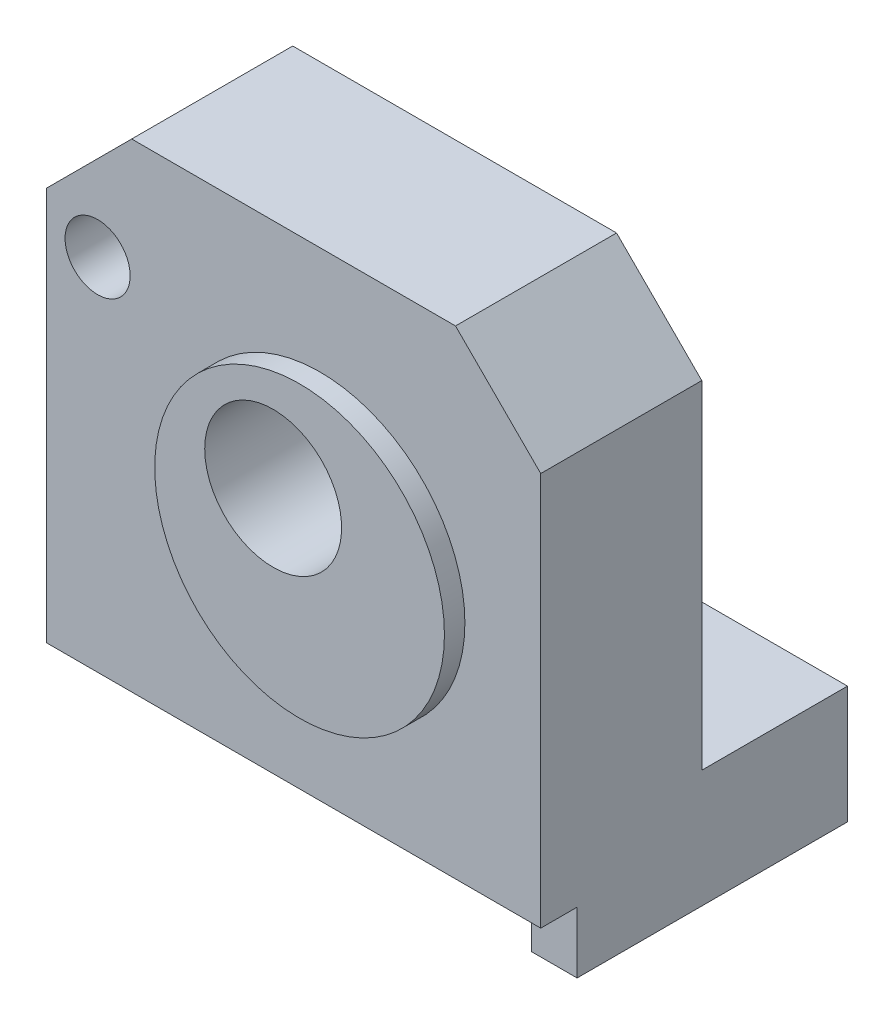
SolidWorks part; units mm, degrees
ref_plane "Front" through (0, 0, 0) normal (0, 0, 1) x (1, 0, 0)
ref_plane "Top" through (0, 0, 0) normal (0, 1, 0) x (1, 0, 0)
ref_plane "Right" through (0, 0, 0) normal (1, 0, 0) x (0, 0, -1)
sketch "Sketch1" plane through (0, 0, 0) normal (0, 0, 1) x (1, 0, 0)
  line L1 (-18.415, 17.399) -> (18.415, 17.399)
  line L2 (-18.415, 17.399) -> (-18.415, -22.479)
  line L3 (-18.415, -22.479) -> (18.415, -22.479)
  line L4 (18.415, 17.399) -> (18.415, -22.479)
  point P4 (0, -22.479)
  dimension "D1" = 36.83
  dimension "D2" = 39.878
  dimension "D3" = 22.479
extrude "Extrude1" add sketch "Sketch1" along normal blind 12
sketch "Sketch7" plane through (0, 0, 0) normal (0, 0, -1) x (-1, 0, 0)
  circle A0 centre (14.605, 6.858) radius 2.4257
  circle A1 centre (14.605, 6.858) radius 2.4892 construction
  dimension "D1" = 4.8514
extrude "Cut-Extrude1" cut sketch "Sketch7" against normal through all
sketch "Sketch8" plane through (0, 0, 0) normal (0, 0, -1) x (-1, 0, 0)
  circle A0 centre (-1.9685, -3.0644) radius 10.795
  circle A1 centre (-1.9685, -3.0644) radius 10.795 construction
extrude "Extrude3" add sketch "Sketch8" against normal offset from surface (13.524 mm away) 1.524
sketch "Sketch11" plane through (0, 0, 12) normal (0, 0, 1) x (1, 0, 0)
  circle A0 centre (18.415, 17.399) radius 9.525
  dimension "D1" = 19.05
extrude "Cut-Extrude2" [suppressed] cut sketch "Sketch11" against normal through all
chamfer "Chamfer1" [suppressed] distance 2.032 angle 45
sketch "Sketch12" plane through (0, 0, 13.524) normal (0, 0, 1) x (1, 0, 0)
  circle A0 centre (0, 0) radius 4.3688
  dimension "D1" = 8.7376
extrude "Cut-Extrude3" cut sketch "Sketch12" against normal through all
sketch "Sketch13" plane through (0, 0, 12) normal (0, 0, 1) x (1, 0, 0)
  line L0 (18.415, -22.479) -> (18.415, 17.399) construction
  line L1 (-18.415, -22.479) -> (18.415, -22.479)
  line L2 (-18.415, -22.479) -> (-18.415, -15.748)
  line L3 (-18.415, -15.748) -> (18.415, -15.748)
  line L4 (18.415, -22.479) -> (18.415, -15.748)
  dimension "D1" = 6.731
extrude "Extrude4" add sketch "Sketch13" against normal blind 22.86
sketch "Sketch14" plane through (0, 0, 0) normal (0, 0, -1) x (-1, 0, 0)
  circle A0 centre (0, 0) radius 7
  dimension "D1" = 14
extrude "Cut-Extrude4" [suppressed] cut sketch "Sketch14" against normal blind 9.5
sketch "Sketch15" plane through (0, -22.479, 0) normal (0, -1, 0) x (1, 0, 0)
  line L0 (-18.415, 12) -> (18.415, 12) construction
  line L1 (18.415, -10.86) -> (15, -10.86)
  line L2 (18.415, -10.86) -> (18.415, 12)
  line L3 (18.415, 12) -> (15, 12)
  line L4 (15, -10.86) -> (15, 12)
  line L6 (-18.415, -10.86) -> (-15, -10.86)
  line L7 (-18.415, -10.86) -> (-18.415, 12)
  line L8 (-18.415, 12) -> (-15, 12)
  line L9 (-15, -10.86) -> (-15, 12)
  dimension "D1" = 3.415
  dimension "D2" = 3.415
extrude "Extrude5" add sketch "Sketch15" along normal blind 2.032
sketch "Sketch17" plane through (0, 0, 0) normal (0, 0, -1) x (-1, 0, 0)
  line L0 (-18.415, -15.748) -> (-18.415, 17.399) construction
  line L1 (18.415, 17.399) -> (-18.415, 17.399)
  line L2 (18.415, 17.399) -> (18.415, 4.699)
  line L3 (18.415, 4.699) -> (-18.415, 4.699)
  line L4 (-18.415, 17.399) -> (-18.415, 4.699)
  dimension "D1" = 12.7
extrude "Cut-Extrude6" [suppressed] cut sketch "Sketch17" against normal blind 3.175
sketch "Sketch18" plane through (0, -24.511, 0) normal (0, -1, 0) x (1, 0, 0)
  line L0 (-18.415, 12) -> (-18.415, -10.86) construction
  line L1 (-15, -10.86) -> (15, -10.86) construction
  circle A0 centre (-10.5, -3.96) radius 1.5494
  dimension "D1" = 3.0988
  dimension "D2" = 7.915
  dimension "D3" = 6.9
extrude "Cut-Extrude7" cut sketch "Sketch18" against normal through all
mirror "Mirror2" about plane through (0, 0, 0) normal (1, 0, 0) of "Cut-Extrude7"
sketch "Sketch23" plane through (0, 17.399, 0) normal (0, 1, 0) x (-1, 0, 0)
  line L1 (-18.415, 12) -> (18.415, 12)
  line L2 (-18.415, 12) -> (-18.415, 0)
  line L3 (-18.415, 0) -> (18.415, 0)
  line L4 (18.415, 12) -> (18.415, 0)
extrude "Cut-Extrude10" cut sketch "Sketch23" against normal blind 1.651
chamfer "Chamfer2" distance 6.35 angle 45 2 edges at (18.415, 15.748, 6) (-18.415, 15.748, 6)
sketch "Sketch19" plane through (-15, 0, 0) normal (1, 0, 0) x (0, 0, -1)
  line L1 (10.86, -22.479) -> (-12, -22.479)
  line L2 (10.86, -22.479) -> (10.86, -24.511)
  line L3 (10.86, -24.511) -> (-12, -24.511)
  line L4 (-12, -22.479) -> (-12, -24.511)
extrude "Cut-Extrude8" cut sketch "Sketch19" against normal through all
hole_wizard "M12x1.00 SPECIAL" positions "Sketch21" profile "Sketch20" tap size "M12x1.75" standard "Ansi Metric"
sketch "Sketch21" plane through (0, 0, 0) normal (0, 0, -1) x (-1, 0, 0)
  circle A0 centre (0, 0) radius 4.3688 construction
  point P0 (0, 0)
sketch "Sketch20" plane through (0, 0, 0) normal (1, 0, 0) x (0, 1, 0)
  line L0 (0, 0) -> (0, 13.524)
  line L1 (0, 13.524) -> (5.1, 13.524)
  line L2 (5.1, 13.524) -> (5.1, 0)
  line L5 (5.1, 0) -> (0, 0)
  line L11 (0, -6.35) -> (0, 107.95) construction
  dimension "Thru Tap Drill Dia." = 10.2
  dimension "Thru Tap Drill Depth" = 13.524
sketch "Sketch22" plane through (0, 0, 0) normal (1, 0, 0) x (0, 0, -1)
  line L0 (-12, -22.479) -> (10.86, -22.479) construction
  line L1 (-12, -24.511) -> (-9.2898, -24.511)
  line L2 (-12, -24.511) -> (-12, -19.939)
  line L3 (-12, -19.939) -> (-9.2898, -19.939)
  line L4 (-9.2898, -24.511) -> (-9.2898, -19.939)
  dimension "D1" = 2.7102
  dimension "D2" = 2.54
extrude "Cut-Extrude9" cut sketch "Sketch22" against normal through all and the other way through all
